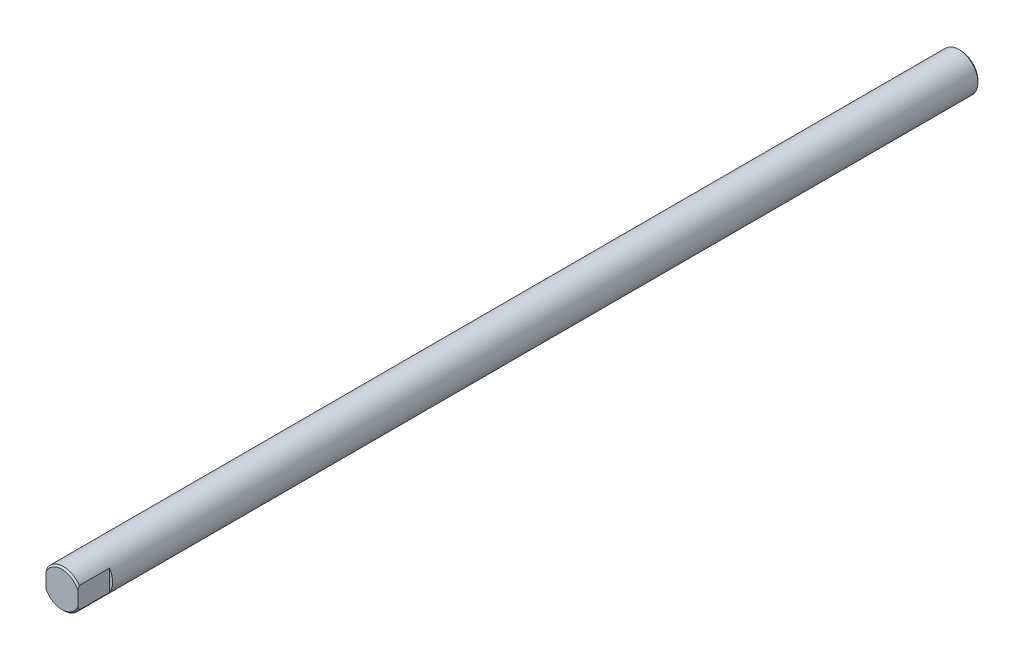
SolidWorks part; units mm, degrees
ref_plane "Face" through (0, 0, 0) normal (0, 0, 1) x (1, 0, 0)
ref_plane "Dessus" through (0, 0, 0) normal (0, 1, 0) x (1, 0, 0)
ref_plane "Droite" through (0, 0, 0) normal (1, 0, 0) x (0, 0, -1)
sketch "Esquisse1" plane through (0, 0, 0) normal (0, 0, 1) x (1, 0, 0)
  circle A0 centre (0, 0) radius 6
  dimension "D1" = 12
extrude "Extrusion1" add sketch "Esquisse1" along normal blind 283
chamfer "Chanfrein1" distance 0.5 angle 45
hole_wizard "Trou taraudé M6x1.01" positions "Esquisse3" profile "Esquisse2" tap size "M6x1.0" standard "ISO"
sketch "Esquisse3" plane through (0, 0, 0) normal (0, 0, -1) x (-1, 0, 0)
  circle A0 centre (0, 0) radius 5.5 construction
  point P0 (0, 0)
sketch "Esquisse2" plane through (0, 0, 0) normal (1, 0, 0) x (0, 1, 0)
  line L0 (0, 0) -> (0, 33.4421)
  line L1 (0, 33.4421) -> (2.4, 32)
  line L2 (2.4, 32) -> (2.4, 0)
  line L5 (2.4, 0) -> (0, 0)
  line L10 (0, 33.4421) -> (-2.4, 32) construction
  line L11 (0, -6.35) -> (0, 107.95) construction
  dimension "Diamètre du trou pour taraudage" = 4.8
  dimension "Profondeur du trou pour taraudage" = 32
  dimension "Angle de pointe" = 118
sketch "Esquisse4" plane through (0, 0, 283) normal (0, 0, 1) x (1, 0, 0)
  line L0 (5, 5.623) -> (5, -6.0089)
  line L1 (5, -6.0089) -> (9.4286, -6.0089)
  line L2 (9.4286, -6.0089) -> (9.4286, 5.623)
  line L3 (9.4286, 5.623) -> (5, 5.623)
  line L4 (-5, 5.8986) -> (-5, -6.211)
  line L5 (-5, -6.211) -> (-8.5465, -6.211)
  line L6 (-8.5465, -6.211) -> (-8.5465, 5.8986)
  line L7 (-8.5465, 5.8986) -> (-5, 5.8986)
  dimension "D1" = 10
  dimension "D2" = 5
extrude "Enlèv. mat.-Extru.1" cut sketch "Esquisse4" against normal blind 10
